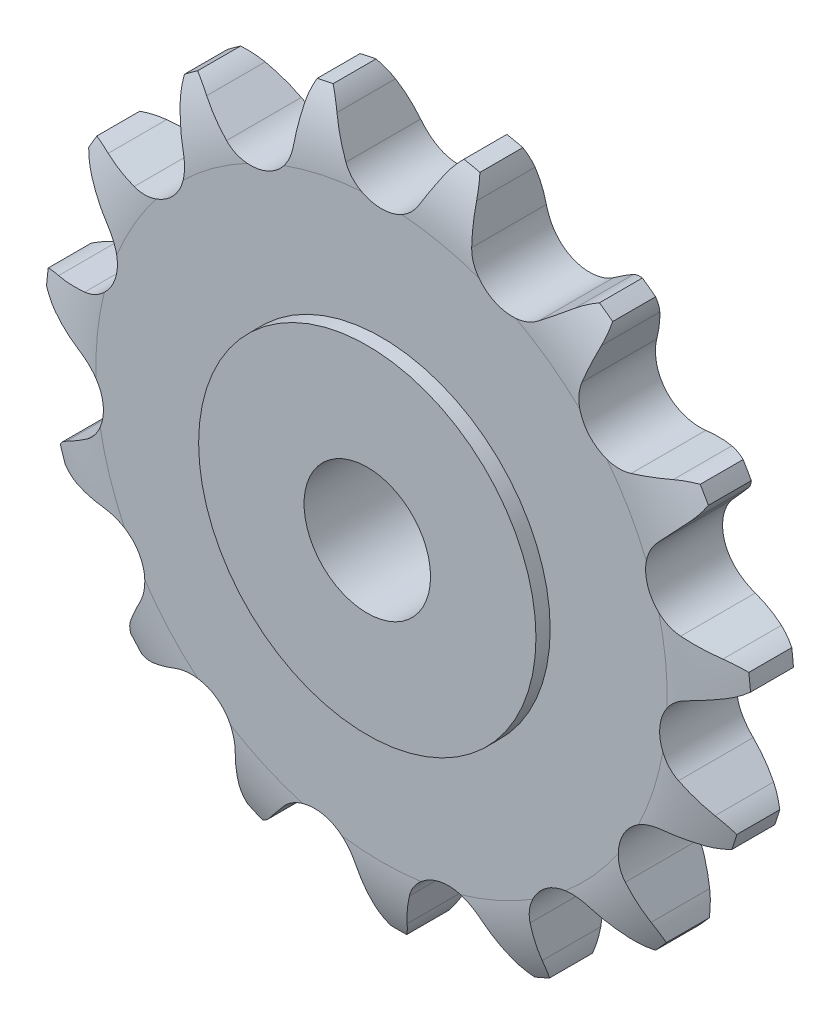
SolidWorks part; units mm, degrees
ref_plane "Front" through (0, 0, 0) normal (0, 0, 1) x (1, 0, 0)
ref_plane "Top" through (0, 0, 0) normal (0, 1, 0) x (1, 0, 0)
ref_plane "Right" through (0, 0, 0) normal (1, 0, 0) x (0, 0, -1)
sketch "ｽｹｯﾁ1" plane through (0, 0, 0) normal (1, 0, 0) x (0, 0, -1)
  line L1 (3.65, 16) -> (3.65, 27.1)
  line L75 (-10, 0) -> (10, 0) construction
  line L78 (2.0365, 33.5) -> (-2.0365, 33.5)
  line L82 (-3.65, 27.1) -> (-3.65, 16)
  line L83 (-5, 16) -> (-5, 6)
  line L86 (-5, 6) -> (5, 6)
  line L87 (5, 16) -> (3.65, 16)
  line L88 (5, 16) -> (5, 6)
  line L91 (-3.65, 16) -> (-5, 16)
  arc A48 (-2.0365, 33.5) -> (-3.65, 27.1) centre (9.85, 27.1) ccw
  arc A49 (3.65, 27.1) -> (2.0365, 33.5) centre (-9.85, 27.1) ccw
revolve "回転1" add sketch "ｽｹｯﾁ1" angle 360 about L75
sketch "ｽｹｯﾁ2" plane through (0, 0, 0) normal (0, 0, 1) x (1, 0, 0)
  line L2 (3.4831, 28.5854) -> (5.1007, 31.4682)
  line L3 (8.4448, 27.5308) -> (8.1395, 30.8223)
  line L4 (-3.4831, 28.5854) -> (-5.1007, 31.4682)
  line L5 (-8.4448, 27.5308) -> (-8.1395, 30.8223)
  line L6 (-14.8087, 24.6974) -> (-17.459, 26.6729)
  line L7 (-18.9125, 21.7158) -> (-19.9723, 24.8469)
  line L8 (-23.5737, 16.539) -> (-26.7985, 17.2657)
  line L9 (-26.11, 12.146) -> (-28.3518, 14.5753)
  line L10 (-28.2627, 5.5208) -> (-31.5042, 4.8731)
  line L11 (-28.7929, 0.476) -> (-31.829, 1.7835)
  line L12 (-28.0648, -6.452) -> (-30.7626, -8.3621)
  line L13 (-26.4972, -11.2763) -> (-29.8026, -11.3167)
  line L14 (-23.0142, -17.3091) -> (-24.7019, -20.1515)
  line L15 (-19.62, -21.0788) -> (-22.6231, -22.4601)
  line L16 (-13.9842, -25.1734) -> (-14.3699, -28.4564)
  line L17 (-9.3502, -27.2366) -> (-11.5319, -29.72)
  line L18 (-2.5363, -28.6849) -> (-1.5533, -31.841)
  line L19 (2.5363, -28.6849) -> (1.5533, -31.841)
  line L20 (9.3502, -27.2366) -> (11.5319, -29.72)
  line L21 (13.9842, -25.1734) -> (14.3699, -28.4564)
  line L22 (19.62, -21.0788) -> (22.6231, -22.4601)
  line L23 (23.0142, -17.3091) -> (24.7019, -20.1515)
  line L24 (26.4972, -11.2763) -> (29.8026, -11.3167)
  line L25 (28.0648, -6.452) -> (30.7626, -8.3621)
  line L26 (28.7929, 0.476) -> (31.829, 1.7835)
  line L27 (28.2627, 5.5208) -> (31.5042, 4.8731)
  line L28 (26.11, 12.146) -> (28.3518, 14.5753)
  line L29 (23.5737, 16.539) -> (26.7985, 17.2657)
  line L30 (18.9125, 21.7158) -> (19.9723, 24.8469)
  line L31 (14.8087, 24.6974) -> (17.459, 26.6729)
  arc A0 (-20.3135, 26.6385) -> (-28.6159, 17.4178) centre (0, 0) ccw
  circle A1 centre (0, 0) radius 33.5 construction
  arc A2 (-3.4831, 28.5854) -> (3.4831, 28.5854) centre (0, 30.54) ccw
  arc A3 (6.2039, 32.9205) -> (5.1007, 31.4682) centre (10.873, 28.229) ccw
  arc A4 (8.1395, 30.8223) -> (7.7225, 32.5978) centre (1.5488, 30.2109) ccw
  arc A5 (8.4448, 27.5308) -> (14.8087, 24.6974) centre (12.4217, 27.8997) ccw
  arc A6 (-14.8087, 24.6974) -> (-8.4448, 27.5308) centre (-12.4217, 27.8997) ccw
  arc A7 (-7.7225, 32.5978) -> (-8.1395, 30.8223) centre (-1.5488, 30.2109) ccw
  arc A8 (-5.1007, 31.4682) -> (-6.2039, 32.9205) centre (-10.873, 28.229) ccw
  arc A9 (-23.5737, 16.539) -> (-18.9125, 21.7158) centre (-22.6956, 20.4352) ccw
  arc A11 (-20.3135, 26.6385) -> (-19.9723, 24.8469) centre (-13.7028, 26.9691) ccw
  arc A12 (-17.459, 26.6729) -> (-19.0575, 27.5511) centre (-21.4147, 21.366) ccw
  arc A13 (-28.2627, 5.5208) -> (-26.11, 12.146) centre (-29.0453, 9.4374) ccw
  arc A15 (-29.3922, 16.0733) -> (-28.3518, 14.5753) centre (-23.4874, 19.0641) ccw
  arc A16 (-26.7985, 17.2657) -> (-28.6159, 17.4178) centre (-28.2537, 10.8087) ccw
  arc A17 (-28.0648, -6.452) -> (-28.7929, 0.476) centre (-30.3727, -3.1923) ccw
  arc A19 (-33.3887, 2.7288) -> (-31.829, 1.7835) centre (-29.2109, 7.8627) ccw
  arc A20 (-31.5042, 4.8731) -> (-33.2264, 4.2728) centre (-30.2073, -1.6176) ccw
  arc A21 (-23.0142, -17.3091) -> (-26.4972, -11.2763) centre (-26.4484, -15.27) ccw
  arc A23 (-31.612, -11.0875) -> (-29.8026, -11.3167) centre (-29.8835, -4.6982) ccw
  arc A24 (-30.7626, -8.3621) -> (-32.0917, -9.611) centre (-26.9378, -13.7642) ccw
  arc A25 (-13.9842, -25.1734) -> (-19.62, -21.0788) centre (-17.951, -24.7074) ccw
  arc A27 (-24.3693, -22.9867) -> (-22.6231, -22.4601) centre (-25.389, -16.4468) ccw
  arc A28 (-24.7019, -20.1515) -> (-25.4081, -21.833) centre (-19.0105, -23.5308) ccw
  arc A29 (-2.5363, -28.6849) -> (-9.3502, -27.2366) centre (-6.3496, -29.8726) ccw
  arc A31 (-12.9129, -30.9113) -> (-11.5319, -29.72) centre (-16.5045, -25.3515) ccw
  arc A32 (-14.3699, -28.4564) -> (-14.3312, -30.2798) centre (-7.7961, -29.2287) ccw
  arc A33 (9.3502, -27.2366) -> (2.5363, -28.6849) centre (6.3496, -29.8726) ccw
  arc A35 (0.7762, -33.491) -> (1.5533, -31.841) centre (-4.7663, -29.8728) ccw
  arc A36 (-1.5533, -31.841) -> (-0.7762, -33.491) centre (4.7663, -29.8728) ccw
  arc A37 (19.62, -21.0788) -> (13.9842, -25.1734) centre (17.951, -24.7074) ccw
  arc A39 (14.3312, -30.2798) -> (14.3699, -28.4564) centre (7.7961, -29.2287) ccw
  arc A40 (11.5319, -29.72) -> (12.9129, -30.9113) centre (16.5045, -25.3515) ccw
  arc A41 (26.4972, -11.2763) -> (23.0142, -17.3091) centre (26.4484, -15.27) ccw
  arc A43 (25.4081, -21.833) -> (24.7019, -20.1515) centre (19.0105, -23.5308) ccw
  arc A44 (22.6231, -22.4601) -> (24.3693, -22.9867) centre (25.389, -16.4468) ccw
  arc A45 (28.7929, 0.476) -> (28.0648, -6.452) centre (30.3727, -3.1923) ccw
  arc A47 (32.0917, -9.611) -> (30.7626, -8.3621) centre (26.9378, -13.7642) ccw
  arc A48 (29.8026, -11.3167) -> (31.612, -11.0875) centre (29.8835, -4.6982) ccw
  arc A49 (26.11, 12.146) -> (28.2627, 5.5208) centre (29.0453, 9.4374) ccw
  arc A51 (33.2264, 4.2728) -> (31.5042, 4.8731) centre (30.2073, -1.6176) ccw
  arc A52 (31.829, 1.7835) -> (33.3887, 2.7288) centre (29.2109, 7.8627) ccw
  arc A53 (18.9125, 21.7158) -> (23.5737, 16.539) centre (22.6956, 20.4352) ccw
  arc A55 (28.6159, 17.4178) -> (26.7985, 17.2657) centre (28.2537, 10.8087) ccw
  arc A56 (28.3518, 14.5753) -> (29.3922, 16.0733) centre (23.4874, 19.0641) ccw
  arc A58 (19.0575, 27.5511) -> (17.459, 26.6729) centre (21.4147, 21.366) ccw
  arc A59 (19.9723, 24.8469) -> (20.3135, 26.6385) centre (13.7028, 26.9691) ccw
  arc A60 (-7.7225, 32.5978) -> (-19.0575, 27.5511) centre (0, 0) ccw
  arc A61 (6.2039, 32.9205) -> (-6.2039, 32.9205) centre (0, 0) ccw
  arc A62 (19.0575, 27.5511) -> (7.7225, 32.5978) centre (0, 0) ccw
  arc A63 (33.2264, 4.2728) -> (29.3922, 16.0733) centre (0, 0) ccw
  arc A64 (32.0917, -9.611) -> (33.3887, 2.7288) centre (0, 0) ccw
  arc A65 (25.4081, -21.833) -> (31.612, -11.0875) centre (0, 0) ccw
  arc A66 (14.3312, -30.2798) -> (24.3693, -22.9867) centre (0, 0) ccw
  arc A67 (0.7762, -33.491) -> (12.9129, -30.9113) centre (0, 0) ccw
  arc A68 (-12.9129, -30.9113) -> (-0.7762, -33.491) centre (0, 0) ccw
  arc A69 (-24.3693, -22.9867) -> (-14.3312, -30.2798) centre (0, 0) ccw
  arc A70 (-31.612, -11.0875) -> (-25.4081, -21.833) centre (0, 0) ccw
  arc A71 (-33.3887, 2.7288) -> (-32.0917, -9.611) centre (0, 0) ccw
  arc A72 (-29.3922, 16.0733) -> (-33.2264, 4.2728) centre (0, 0) ccw
  arc A74 (28.6159, 17.4178) -> (20.3135, 26.6385) centre (0, 0) ccw
extrude "ｶｯﾄ - 押し出し1" cut sketch "ｽｹｯﾁ2" against normal through all both and the other way through all
